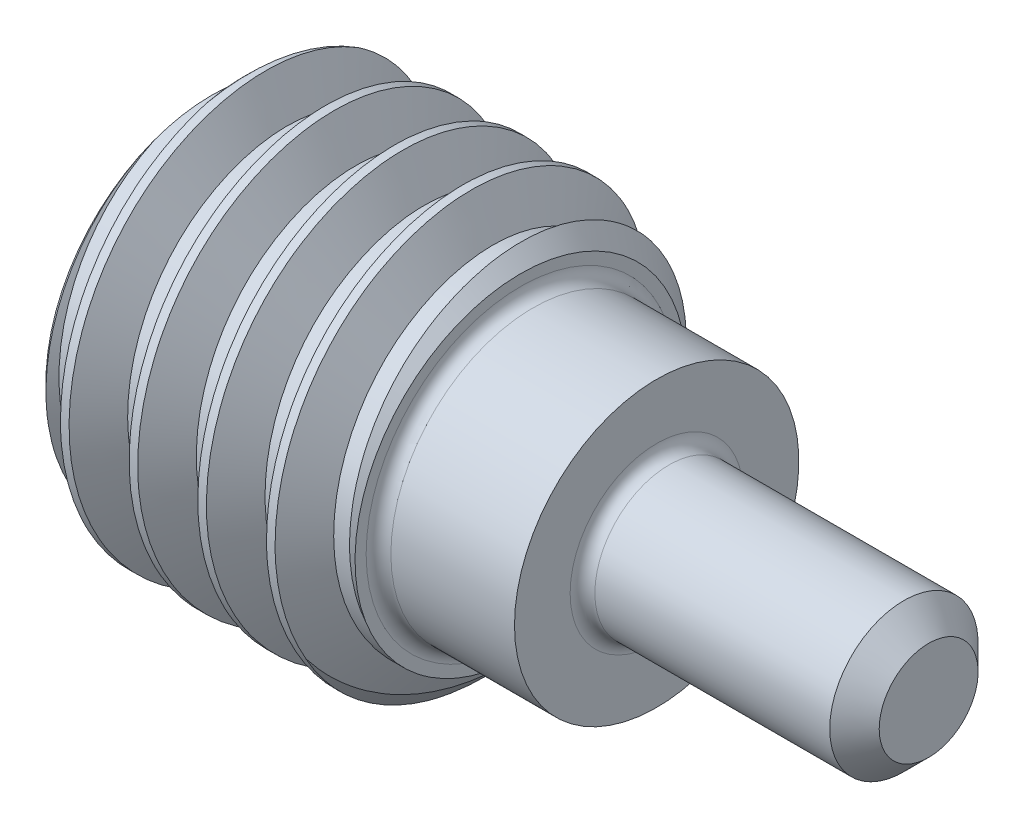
SolidWorks part; units mm, degrees
ref_plane "Front Plane" through (0, 0, 0) normal (0, 0, 1) x (1, 0, 0)
ref_plane "Top Plane" through (0, 0, 0) normal (0, 1, 0) x (1, 0, 0)
ref_plane "Right Plane" through (0, 0, 0) normal (1, 0, 0) x (0, 0, -1)
sketch "Sketch1" plane through (0, 0, 0) normal (0, 0, 1) x (1, 0, 0)
  line L0 (0, 6.4865) -> (0, 0) construction
  line L1 (0, 0) -> (11.3802, 0) construction
  line L2 (0, 0) -> (0, 1.7018)
  line L3 (0.381, 2.0828) -> (2.794, 2.0828)
  line L4 (3.175, 1.7018) -> (3.175, 1.5875)
  line L5 (3.302, 1.4605) -> (4.572, 1.4605)
  line L6 (4.572, 1.4605) -> (4.572, 0.889)
  line L7 (4.699, 0.762) -> (7.112, 0.762)
  line L8 (7.366, 0.508) -> (7.366, 0)
  line L9 (0, 1.7018) -> (0.381, 2.0828)
  line L10 (2.794, 2.0828) -> (3.175, 1.7018)
  line L11 (7.112, 0.762) -> (7.366, 0.508)
  line L12 (0, 0) -> (7.366, 0)
  arc A0 (4.572, 0.889) -> (4.699, 0.762) centre (4.699, 0.889) ccw
  arc A1 (3.175, 1.5875) -> (3.302, 1.4605) centre (3.302, 1.5875) ccw
  point P5 (3.175, 2.0828)
  point P6 (0, 2.0828)
  point P10 (7.366, 0.762)
  point P19 (4.572, 0.762)
  dimension "D7" = 0.127
  dimension "D1" = 7.366
  dimension "D2" = 4.191
  dimension "D3" = 2.794
  dimension "D4" = 4.1656
  dimension "D5" = 2.921
  dimension "D6" = 1.524
revolve "Revolve1" add sketch "Sketch1" angle 360 about L12
thread "Thread1" pitch 0.7056 start angle 0, offset 1.524, length 5.08, pitch 0.7056, diameter 4.1656
ref_plane "Plane1" through (-1.143, 0, -2.0828) normal (0, -1, 0) x (0, 0, -1)
sketch "Thread Profile1" plane through (-1.143, 0, -2.0828) normal (0, -1, 0) x (0, 0, -1)
  line L0 (0, 0) -> (0, 0.7056) construction
  line L11 (0, 0) -> (0, 0.6174)
  line L12 (0, 0.6174) -> (-0.3819, 0.3969)
  line L13 (-0.3819, 0.3969) -> (-0.3819, 0.2205)
  line L15 (-0.3819, 0.2205) -> (0, 0)
  line L17 (-0.3819, 0.3087) -> (0, 0.3087) construction
  point P2 (0, 0)
  dimension "Pitch" = 0.7056
  dimension "Profile_Angle" = 60
  dimension "Profile_Land" = 0.1764
  dimension "Profile_Height" = 0.3819
sketch "Sketch4" plane through (0, 0, 0) normal (-1, 0, 0) x (0, 0, 1)
  line L1 (0, 1.1438) -> (-0.9906, 0.5719)
  line L2 (-0.9906, 0.5719) -> (-0.9906, -0.5719)
  line L3 (-0.9906, -0.5719) -> (0, -1.1438)
  line L4 (0, -1.1438) -> (0.9906, -0.5719)
  line L5 (0.9906, -0.5719) -> (0.9906, 0.5719)
  line L6 (0.9906, 0.5719) -> (0, 1.1438)
  circle A0 centre (0, 0) radius 0.9906 construction
  dimension "D1" = 1.9812
extrude "Cut-Extrude1" cut sketch "Sketch4" against normal blind 1.524
sketch "Sketch5" plane through (1.524, 0, 0) normal (-1, 0, 0) x (0, 0, 1)
  circle A0 centre (0, 0) radius 0.9906
extrude "Cut-Extrude2" cut sketch "Sketch5" against normal blind 0.508 draft 60
